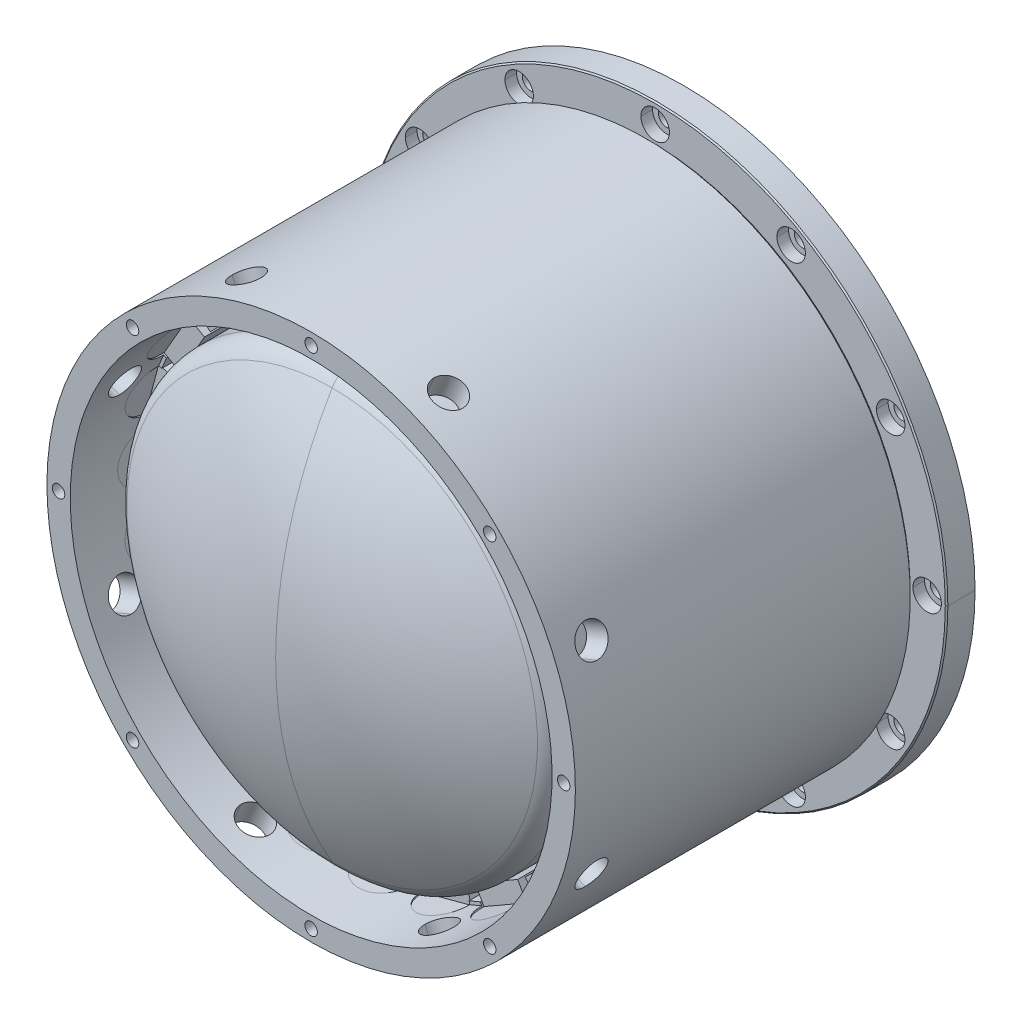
SolidWorks part; units mm, degrees
ref_plane "Front Plane" through (0, 0, 0) normal (0, 0, 1) x (1, 0, 0)
ref_plane "Top Plane" through (0, 0, 0) normal (0, 1, 0) x (1, 0, 0)
ref_plane "Right Plane" through (0, 0, 0) normal (1, 0, 0) x (0, 0, -1)
imported_body "561108_asm KTR magnetic coup.STEP-1/561108_asm.stp.STEP-1/398987_AF0_ASM.stp.STEP-1/398986_AF1_ASM.stp.STEP-1/402236_AF0_ASM.stp.STEP-1/400436_AF0.stp.STEP-1-solid1"
imported_body "561108_asm KTR magnetic coup.STEP-1/561108_asm.stp.STEP-1/398987_AF0_ASM.stp.STEP-1/398986_AF1_ASM.stp.STEP-1/402236_AF0_ASM.stp.STEP-1/400436_AF1.stp.STEP-1-solid1"
imported_body "561108_asm KTR magnetic coup.STEP-1/561108_asm.stp.STEP-1/398987_AF0_ASM.stp.STEP-1/398986_AF1_ASM.stp.STEP-1/402236_AF0_ASM.stp.STEP-1/400436_AF2.stp.STEP-1-solid1"
imported_body "561108_asm KTR magnetic coup.STEP-1/561108_asm.stp.STEP-1/398987_AF0_ASM.stp.STEP-1/398986_AF1_ASM.stp.STEP-1/402236_AF0_ASM.stp.STEP-1/400436_AF3.stp.STEP-1-solid1"
imported_body "561108_asm KTR magnetic coup.STEP-1/561108_asm.stp.STEP-1/398987_AF0_ASM.stp.STEP-1/398986_AF1_ASM.stp.STEP-1/402236_AF0_ASM.stp.STEP-1/400436_AF4.stp.STEP-1-solid1"
imported_body "561108_asm KTR magnetic coup.STEP-1/561108_asm.stp.STEP-1/398987_AF0_ASM.stp.STEP-1/398986_AF1_ASM.stp.STEP-1/402236_AF0_ASM.stp.STEP-1/400436_AF5.stp.STEP-1-solid1"
imported_body "561108_asm KTR magnetic coup.STEP-1/561108_asm.stp.STEP-1/398987_AF0_ASM.stp.STEP-1/398986_AF1_ASM.stp.STEP-1/402236_AF0_ASM.stp.STEP-1/400436_AF6.stp.STEP-1-solid1"
imported_body "561108_asm KTR magnetic coup.STEP-1/561108_asm.stp.STEP-1/398987_AF0_ASM.stp.STEP-1/398986_AF1_ASM.stp.STEP-1/402236_AF0_ASM.stp.STEP-1/400436_AF7.stp.STEP-1-solid1"
imported_body "561108_asm KTR magnetic coup.STEP-1/561108_asm.stp.STEP-1/398987_AF0_ASM.stp.STEP-1/398986_AF1_ASM.stp.STEP-1/402236_AF0_ASM.stp.STEP-1/400436_AF8.stp.STEP-1-solid1"
imported_body "561108_asm KTR magnetic coup.STEP-1/561108_asm.stp.STEP-1/398987_AF0_ASM.stp.STEP-1/398986_AF1_ASM.stp.STEP-1/402236_AF0_ASM.stp.STEP-1/400436_AF9.stp.STEP-1-solid1"
imported_body "561108_asm KTR magnetic coup.STEP-1/561108_asm.stp.STEP-1/398987_AF0_ASM.stp.STEP-1/398986_AF1_ASM.stp.STEP-1/402236_AF0_ASM.stp.STEP-1/400436_AF10.stp.STEP-1-solid1"
imported_body "561108_asm KTR magnetic coup.STEP-1/561108_asm.stp.STEP-1/398987_AF0_ASM.stp.STEP-1/398986_AF1_ASM.stp.STEP-1/402236_AF0_ASM.stp.STEP-1/400436_AF11.stp.STEP-1-solid1"
imported_body "561108_asm KTR magnetic coup.STEP-1/561108_asm.stp.STEP-1/398987_AF0_ASM.stp.STEP-1/398986_AF1_ASM.stp.STEP-1/402236_AF0_ASM.stp.STEP-1/400436_AF12.stp.STEP-1-solid1"
imported_body "561108_asm KTR magnetic coup.STEP-1/561108_asm.stp.STEP-1/398987_AF0_ASM.stp.STEP-1/398986_AF1_ASM.stp.STEP-1/402236_AF0_ASM.stp.STEP-1/400436_AF13.stp.STEP-1-solid1"
imported_body "561108_asm KTR magnetic coup.STEP-1/561108_asm.stp.STEP-1/398987_AF0_ASM.stp.STEP-1/398986_AF1_ASM.stp.STEP-1/402236_AF0_ASM.stp.STEP-1/400436_AF14.stp.STEP-1-solid1"
imported_body "561108_asm KTR magnetic coup.STEP-1/561108_asm.stp.STEP-1/398987_AF0_ASM.stp.STEP-1/398986_AF1_ASM.stp.STEP-1/402236_AF0_ASM.stp.STEP-1/400436_AF15.stp.STEP-1-solid1"
imported_body "561108_asm KTR magnetic coup.STEP-1/561108_asm.stp.STEP-1/398987_AF0_ASM.stp.STEP-1/398986_AF1_ASM.stp.STEP-1/402236_AF0_ASM.stp.STEP-1/400436_AF16.stp.STEP-1-solid1"
imported_body "561108_asm KTR magnetic coup.STEP-1/561108_asm.stp.STEP-1/398987_AF0_ASM.stp.STEP-1/398986_AF1_ASM.stp.STEP-1/402236_AF0_ASM.stp.STEP-1/400436_AF17.stp.STEP-1-solid1"
imported_body "561108_asm KTR magnetic coup.STEP-1/561108_asm.stp.STEP-1/398987_AF0_ASM.stp.STEP-1/398986_AF1_ASM.stp.STEP-1/402236_AF0_ASM.stp.STEP-1/400436_AF18.stp.STEP-1-solid1"
imported_body "561108_asm KTR magnetic coup.STEP-1/561108_asm.stp.STEP-1/398987_AF0_ASM.stp.STEP-1/398986_AF1_ASM.stp.STEP-1/402236_AF0_ASM.stp.STEP-1/400436_AF19.stp.STEP-1-solid1"
imported_body "561108_asm KTR magnetic coup.STEP-1/561108_asm.stp.STEP-1/398987_AF0_ASM.stp.STEP-1/398986_AF1_ASM.stp.STEP-1/402236_AF0_ASM.stp.STEP-1/400436_AF20.stp.STEP-1-solid1"
imported_body "561108_asm KTR magnetic coup.STEP-1/561108_asm.stp.STEP-1/398987_AF0_ASM.stp.STEP-1/398986_AF1_ASM.stp.STEP-1/402236_AF0_ASM.stp.STEP-1/400436_AF21.stp.STEP-1-solid1"
imported_body "561108_asm KTR magnetic coup.STEP-1/561108_asm.stp.STEP-1/398987_AF0_ASM.stp.STEP-1/398986_AF1_ASM.stp.STEP-1/402236_AF0_ASM.stp.STEP-1/400436_AF22.stp.STEP-1-solid1"
imported_body "561108_asm KTR magnetic coup.STEP-1/561108_asm.stp.STEP-1/398987_AF0_ASM.stp.STEP-1/398986_AF1_ASM.stp.STEP-1/402236_AF0_ASM.stp.STEP-1/400436_AF23.stp.STEP-1-solid1"
imported_body "561108_asm KTR magnetic coup.STEP-1/561108_asm.stp.STEP-1/398987_AF0_ASM.stp.STEP-1/398986_AF1_ASM.stp.STEP-1/397990_AF2_ASM.stp.STEP-1/397983_AF24.stp.STEP-1-solid1"
imported_body "561108_asm KTR magnetic coup.STEP-1/561108_asm.stp.STEP-1/398987_AF0_ASM.stp.STEP-1/398986_AF1_ASM.stp.STEP-1/397990_AF2_ASM.stp.STEP-1/397983_AF25.stp.STEP-1-solid1"
imported_body "561108_asm KTR magnetic coup.STEP-1/561108_asm.stp.STEP-1/398987_AF0_ASM.stp.STEP-1/398986_AF1_ASM.stp.STEP-1/397990_AF2_ASM.stp.STEP-1/397983_AF26.stp.STEP-1-solid1"
imported_body "561108_asm KTR magnetic coup.STEP-1/561108_asm.stp.STEP-1/398987_AF0_ASM.stp.STEP-1/398986_AF1_ASM.stp.STEP-1/397990_AF2_ASM.stp.STEP-1/397983_AF27.stp.STEP-1-solid1"
imported_body "561108_asm KTR magnetic coup.STEP-1/561108_asm.stp.STEP-1/398987_AF0_ASM.stp.STEP-1/398986_AF1_ASM.stp.STEP-1/397990_AF2_ASM.stp.STEP-1/397983_AF28.stp.STEP-1-solid1"
imported_body "561108_asm KTR magnetic coup.STEP-1/561108_asm.stp.STEP-1/398987_AF0_ASM.stp.STEP-1/398986_AF1_ASM.stp.STEP-1/397990_AF2_ASM.stp.STEP-1/397983_AF29.stp.STEP-1-solid1"
imported_body "561108_asm KTR magnetic coup.STEP-1/561108_asm.stp.STEP-1/398987_AF0_ASM.stp.STEP-1/398986_AF1_ASM.stp.STEP-1/397990_AF2_ASM.stp.STEP-1/397983_AF30.stp.STEP-1-solid1"
imported_body "561108_asm KTR magnetic coup.STEP-1/561108_asm.stp.STEP-1/398987_AF0_ASM.stp.STEP-1/398986_AF1_ASM.stp.STEP-1/397990_AF2_ASM.stp.STEP-1/397983_AF31.stp.STEP-1-solid1"
imported_body "561108_asm KTR magnetic coup.STEP-1/561108_asm.stp.STEP-1/398987_AF0_ASM.stp.STEP-1/398986_AF1_ASM.stp.STEP-1/397990_AF2_ASM.stp.STEP-1/397983_AF32.stp.STEP-1-solid1"
imported_body "561108_asm KTR magnetic coup.STEP-1/561108_asm.stp.STEP-1/398987_AF0_ASM.stp.STEP-1/398986_AF1_ASM.stp.STEP-1/397990_AF2_ASM.stp.STEP-1/397983_AF33.stp.STEP-1-solid1"
imported_body "561108_asm KTR magnetic coup.STEP-1/561108_asm.stp.STEP-1/398987_AF0_ASM.stp.STEP-1/398986_AF1_ASM.stp.STEP-1/397990_AF2_ASM.stp.STEP-1/397983_AF34.stp.STEP-1-solid1"
imported_body "561108_asm KTR magnetic coup.STEP-1/561108_asm.stp.STEP-1/398987_AF0_ASM.stp.STEP-1/398986_AF1_ASM.stp.STEP-1/397990_AF2_ASM.stp.STEP-1/397983_AF35.stp.STEP-1-solid1"
imported_body "561108_asm KTR magnetic coup.STEP-1/561108_asm.stp.STEP-1/398987_AF0_ASM.stp.STEP-1/398986_AF1_ASM.stp.STEP-1/397990_AF2_ASM.stp.STEP-1/397983_AF36.stp.STEP-1-solid1"
imported_body "561108_asm KTR magnetic coup.STEP-1/561108_asm.stp.STEP-1/398987_AF0_ASM.stp.STEP-1/398986_AF1_ASM.stp.STEP-1/397990_AF2_ASM.stp.STEP-1/397983_AF37.stp.STEP-1-solid1"
imported_body "561108_asm KTR magnetic coup.STEP-1/561108_asm.stp.STEP-1/398987_AF0_ASM.stp.STEP-1/398986_AF1_ASM.stp.STEP-1/397990_AF2_ASM.stp.STEP-1/397983_AF38.stp.STEP-1-solid1"
imported_body "561108_asm KTR magnetic coup.STEP-1/561108_asm.stp.STEP-1/398987_AF0_ASM.stp.STEP-1/398986_AF1_ASM.stp.STEP-1/397990_AF2_ASM.stp.STEP-1/397983_AF39.stp.STEP-1-solid1"
imported_body "561108_asm KTR magnetic coup.STEP-1/561108_asm.stp.STEP-1/398987_AF0_ASM.stp.STEP-1/398986_AF1_ASM.stp.STEP-1/397990_AF2_ASM.stp.STEP-1/397983_AF40.stp.STEP-1-solid1"
imported_body "561108_asm KTR magnetic coup.STEP-1/561108_asm.stp.STEP-1/398987_AF0_ASM.stp.STEP-1/398986_AF1_ASM.stp.STEP-1/397990_AF2_ASM.stp.STEP-1/397983_AF41.stp.STEP-1-solid1"
imported_body "561108_asm KTR magnetic coup.STEP-1/561108_asm.stp.STEP-1/398987_AF0_ASM.stp.STEP-1/398986_AF1_ASM.stp.STEP-1/397990_AF2_ASM.stp.STEP-1/397983_AF42.stp.STEP-1-solid1"
imported_body "561108_asm KTR magnetic coup.STEP-1/561108_asm.stp.STEP-1/398987_AF0_ASM.stp.STEP-1/398986_AF1_ASM.stp.STEP-1/397990_AF2_ASM.stp.STEP-1/397983_AF43.stp.STEP-1-solid1"
imported_body "561108_asm KTR magnetic coup.STEP-1/561108_asm.stp.STEP-1/398987_AF0_ASM.stp.STEP-1/398986_AF1_ASM.stp.STEP-1/397990_AF2_ASM.stp.STEP-1/397983_AF44.stp.STEP-1-solid1"
imported_body "561108_asm KTR magnetic coup.STEP-1/561108_asm.stp.STEP-1/398987_AF0_ASM.stp.STEP-1/398986_AF1_ASM.stp.STEP-1/397990_AF2_ASM.stp.STEP-1/397983_AF45.stp.STEP-1-solid1"
imported_body "561108_asm KTR magnetic coup.STEP-1/561108_asm.stp.STEP-1/398987_AF0_ASM.stp.STEP-1/398986_AF1_ASM.stp.STEP-1/397990_AF2_ASM.stp.STEP-1/397983_AF46.stp.STEP-1-solid1"
imported_body "561108_asm KTR magnetic coup.STEP-1/561108_asm.stp.STEP-1/398987_AF0_ASM.stp.STEP-1/398986_AF1_ASM.stp.STEP-1/397990_AF2_ASM.stp.STEP-1/397983_AF47.stp.STEP-1-solid1"
imported_body "561108_asm KTR magnetic coup.STEP-1/561108_asm.stp.STEP-1/398987_AF0_ASM.stp.STEP-1/398986_AF1_ASM.stp.STEP-1/398984_AF2.stp.STEP-1-solid1"
imported_body "561108_asm KTR magnetic coup.STEP-1/561108_asm.stp.STEP-1/398987_AF0_ASM.stp.STEP-1/398986_AF1_ASM.stp.STEP-1/398983_AF2.stp.STEP-1-solid1"
imported_body "561108_asm KTR magnetic coup.STEP-1/561108_asm.stp.STEP-1/398987_AF0_ASM.stp.STEP-1/438211_AF1_ASM.stp.STEP-1/438210_AF0.stp.STEP-1-solid1"
imported_body "561108_asm KTR magnetic coup.STEP-1/561108_asm.stp.STEP-1/398987_AF0_ASM.stp.STEP-1/438211_AF1_ASM.stp.STEP-1/436052_AF0.stp.STEP-1-solid1"
imported_body "561108_asm KTR magnetic coup.STEP-1/561108_asm.stp.STEP-1/533978_ASM.stp.STEP-1/522625_AF0.stp.STEP-1-solid1"
imported_body "561108_asm KTR magnetic coup.STEP-1/561108_asm.stp.STEP-1/533994_ASM.stp.STEP-1/534002_ASM.stp.STEP-1/440571.stp.STEP-1-solid1"
imported_body "561108_asm KTR magnetic coup.STEP-1/561108_asm.stp.STEP-1/533994_ASM.stp.STEP-1/534002_ASM.stp.STEP-1/440571.stp.STEP-2-solid1"
imported_body "561108_asm KTR magnetic coup.STEP-1/561108_asm.stp.STEP-1/533994_ASM.stp.STEP-1/534002_ASM.stp.STEP-1/440571.stp.STEP-3-solid1"
imported_body "561108_asm KTR magnetic coup.STEP-1/561108_asm.stp.STEP-1/533994_ASM.stp.STEP-1/534002_ASM.stp.STEP-1/440571.stp.STEP-4-solid1"
imported_body "561108_asm KTR magnetic coup.STEP-1/561108_asm.stp.STEP-1/533994_ASM.stp.STEP-1/534002_ASM.stp.STEP-1/440571.stp.STEP-5-solid1"
imported_body "561108_asm KTR magnetic coup.STEP-1/561108_asm.stp.STEP-1/533994_ASM.stp.STEP-1/534002_ASM.stp.STEP-1/440571.stp.STEP-6-solid1"
imported_body "561108_asm KTR magnetic coup.STEP-1/561108_asm.stp.STEP-1/533994_ASM.stp.STEP-1/534002_ASM.stp.STEP-1/440571.stp.STEP-7-solid1"
imported_body "561108_asm KTR magnetic coup.STEP-1/561108_asm.stp.STEP-1/533994_ASM.stp.STEP-1/534002_ASM.stp.STEP-1/440571.stp.STEP-8-solid1"
imported_body "561108_asm KTR magnetic coup.STEP-1/561108_asm.stp.STEP-1/533994_ASM.stp.STEP-1/534002_ASM.stp.STEP-1/440571.stp.STEP-9-solid1"
imported_body "561108_asm KTR magnetic coup.STEP-1/561108_asm.stp.STEP-1/533994_ASM.stp.STEP-1/534002_ASM.stp.STEP-1/440571.stp.STEP-10-solid1"
imported_body "561108_asm KTR magnetic coup.STEP-1/561108_asm.stp.STEP-1/533994_ASM.stp.STEP-1/534002_ASM.stp.STEP-1/440571.stp.STEP-11-solid1"
imported_body "561108_asm KTR magnetic coup.STEP-1/561108_asm.stp.STEP-1/533994_ASM.stp.STEP-1/534002_ASM.stp.STEP-1/440571.stp.STEP-12-solid1"
imported_body "561108_asm KTR magnetic coup.STEP-1/561108_asm.stp.STEP-1/533994_ASM.stp.STEP-1/534002_ASM.stp.STEP-1/440571.stp.STEP-13-solid1"
imported_body "561108_asm KTR magnetic coup.STEP-1/561108_asm.stp.STEP-1/533994_ASM.stp.STEP-1/534002_ASM.stp.STEP-1/440571.stp.STEP-14-solid1"
imported_body "561108_asm KTR magnetic coup.STEP-1/561108_asm.stp.STEP-1/533994_ASM.stp.STEP-1/534002_ASM.stp.STEP-1/440571.stp.STEP-15-solid1"
imported_body "561108_asm KTR magnetic coup.STEP-1/561108_asm.stp.STEP-1/533994_ASM.stp.STEP-1/534002_ASM.stp.STEP-1/440571.stp.STEP-16-solid1"
imported_body "561108_asm KTR magnetic coup.STEP-1/561108_asm.stp.STEP-1/533994_ASM.stp.STEP-1/534002_ASM.stp.STEP-1/440571.stp.STEP-17-solid1"
imported_body "561108_asm KTR magnetic coup.STEP-1/561108_asm.stp.STEP-1/533994_ASM.stp.STEP-1/534002_ASM.stp.STEP-1/440571.stp.STEP-18-solid1"
imported_body "561108_asm KTR magnetic coup.STEP-1/561108_asm.stp.STEP-1/533994_ASM.stp.STEP-1/534002_ASM.stp.STEP-1/440571.stp.STEP-19-solid1"
imported_body "561108_asm KTR magnetic coup.STEP-1/561108_asm.stp.STEP-1/533994_ASM.stp.STEP-1/534002_ASM.stp.STEP-1/440571.stp.STEP-20-solid1"
imported_body "561108_asm KTR magnetic coup.STEP-1/561108_asm.stp.STEP-1/533994_ASM.stp.STEP-1/534002_ASM.stp.STEP-1/440571.stp.STEP-21-solid1"
imported_body "561108_asm KTR magnetic coup.STEP-1/561108_asm.stp.STEP-1/533994_ASM.stp.STEP-1/534002_ASM.stp.STEP-1/440571.stp.STEP-22-solid1"
imported_body "561108_asm KTR magnetic coup.STEP-1/561108_asm.stp.STEP-1/533994_ASM.stp.STEP-1/534002_ASM.stp.STEP-1/440571.stp.STEP-23-solid1"
imported_body "561108_asm KTR magnetic coup.STEP-1/561108_asm.stp.STEP-1/533994_ASM.stp.STEP-1/534002_ASM.stp.STEP-1/440571.stp.STEP-24-solid1"
imported_body "561108_asm KTR magnetic coup.STEP-1/561108_asm.stp.STEP-1/533994_ASM.stp.STEP-1/534003_ASM.stp.STEP-1/469764.stp.STEP-1-solid1"
imported_body "561108_asm KTR magnetic coup.STEP-1/561108_asm.stp.STEP-1/533994_ASM.stp.STEP-1/534003_ASM.stp.STEP-1/469764.stp.STEP-2-solid1"
imported_body "561108_asm KTR magnetic coup.STEP-1/561108_asm.stp.STEP-1/533994_ASM.stp.STEP-1/534003_ASM.stp.STEP-1/469764.stp.STEP-3-solid1"
imported_body "561108_asm KTR magnetic coup.STEP-1/561108_asm.stp.STEP-1/533994_ASM.stp.STEP-1/534003_ASM.stp.STEP-1/469764.stp.STEP-4-solid1"
imported_body "561108_asm KTR magnetic coup.STEP-1/561108_asm.stp.STEP-1/533994_ASM.stp.STEP-1/534003_ASM.stp.STEP-1/469764.stp.STEP-5-solid1"
imported_body "561108_asm KTR magnetic coup.STEP-1/561108_asm.stp.STEP-1/533994_ASM.stp.STEP-1/534003_ASM.stp.STEP-1/469764.stp.STEP-6-solid1"
imported_body "561108_asm KTR magnetic coup.STEP-1/561108_asm.stp.STEP-1/533994_ASM.stp.STEP-1/534003_ASM.stp.STEP-1/469764.stp.STEP-7-solid1"
imported_body "561108_asm KTR magnetic coup.STEP-1/561108_asm.stp.STEP-1/533994_ASM.stp.STEP-1/534003_ASM.stp.STEP-1/469764.stp.STEP-8-solid1"
imported_body "561108_asm KTR magnetic coup.STEP-1/561108_asm.stp.STEP-1/533994_ASM.stp.STEP-1/534003_ASM.stp.STEP-1/469764.stp.STEP-9-solid1"
imported_body "561108_asm KTR magnetic coup.STEP-1/561108_asm.stp.STEP-1/533994_ASM.stp.STEP-1/534003_ASM.stp.STEP-1/469764.stp.STEP-10-solid1"
imported_body "561108_asm KTR magnetic coup.STEP-1/561108_asm.stp.STEP-1/533994_ASM.stp.STEP-1/534003_ASM.stp.STEP-1/469764.stp.STEP-11-solid1"
imported_body "561108_asm KTR magnetic coup.STEP-1/561108_asm.stp.STEP-1/533994_ASM.stp.STEP-1/534003_ASM.stp.STEP-1/469764.stp.STEP-12-solid1"
imported_body "561108_asm KTR magnetic coup.STEP-1/561108_asm.stp.STEP-1/533994_ASM.stp.STEP-1/534003_ASM.stp.STEP-1/469764.stp.STEP-13-solid1"
imported_body "561108_asm KTR magnetic coup.STEP-1/561108_asm.stp.STEP-1/533994_ASM.stp.STEP-1/534003_ASM.stp.STEP-1/469764.stp.STEP-14-solid1"
imported_body "561108_asm KTR magnetic coup.STEP-1/561108_asm.stp.STEP-1/533994_ASM.stp.STEP-1/534003_ASM.stp.STEP-1/469764.stp.STEP-15-solid1"
imported_body "561108_asm KTR magnetic coup.STEP-1/561108_asm.stp.STEP-1/533994_ASM.stp.STEP-1/534003_ASM.stp.STEP-1/469764.stp.STEP-16-solid1"
imported_body "561108_asm KTR magnetic coup.STEP-1/561108_asm.stp.STEP-1/533994_ASM.stp.STEP-1/534003_ASM.stp.STEP-1/469764.stp.STEP-17-solid1"
imported_body "561108_asm KTR magnetic coup.STEP-1/561108_asm.stp.STEP-1/533994_ASM.stp.STEP-1/534003_ASM.stp.STEP-1/469764.stp.STEP-18-solid1"
imported_body "561108_asm KTR magnetic coup.STEP-1/561108_asm.stp.STEP-1/533994_ASM.stp.STEP-1/534003_ASM.stp.STEP-1/469764.stp.STEP-19-solid1"
imported_body "561108_asm KTR magnetic coup.STEP-1/561108_asm.stp.STEP-1/533994_ASM.stp.STEP-1/534003_ASM.stp.STEP-1/469764.stp.STEP-20-solid1"
imported_body "561108_asm KTR magnetic coup.STEP-1/561108_asm.stp.STEP-1/533994_ASM.stp.STEP-1/534003_ASM.stp.STEP-1/469764.stp.STEP-21-solid1"
imported_body "561108_asm KTR magnetic coup.STEP-1/561108_asm.stp.STEP-1/533994_ASM.stp.STEP-1/534003_ASM.stp.STEP-1/469764.stp.STEP-22-solid1"
imported_body "561108_asm KTR magnetic coup.STEP-1/561108_asm.stp.STEP-1/533994_ASM.stp.STEP-1/534003_ASM.stp.STEP-1/469764.stp.STEP-23-solid1"
imported_body "561108_asm KTR magnetic coup.STEP-1/561108_asm.stp.STEP-1/533994_ASM.stp.STEP-1/534003_ASM.stp.STEP-1/469764.stp.STEP-24-solid1"
imported_body "561108_asm KTR magnetic coup.STEP-1/561108_asm.stp.STEP-1/533994_ASM.stp.STEP-1/533993.stp.STEP-1-solid1"
imported_body "561108_asm KTR magnetic coup.STEP-1/561108_asm.stp.STEP-1/533994_ASM.stp.STEP-1/533993.stp.STEP-1-surface1"
imported_body "561108_asm KTR magnetic coup.STEP-1/561108_asm.stp.STEP-1/533994_ASM.stp.STEP-1/533993.stp.STEP-1-surface2"
imported_body "561108_asm KTR magnetic coup.STEP-1/561108_asm.stp.STEP-1/533994_ASM.stp.STEP-1/533993.stp.STEP-1-surface3"
imported_body "561108_asm KTR magnetic coup.STEP-1/561108_asm.stp.STEP-1/533994_ASM.stp.STEP-1/533993.stp.STEP-1-surface4"
imported_body "561108_asm KTR magnetic coup.STEP-1/561108_asm.stp.STEP-1/533994_ASM.stp.STEP-1/533993.stp.STEP-1-surface5"
imported_body "561108_asm KTR magnetic coup.STEP-1/561108_asm.stp.STEP-1/533994_ASM.stp.STEP-1/533993.stp.STEP-1-surface6"
imported_body "561108_asm KTR magnetic coup.STEP-1/561108_asm.stp.STEP-1/533994_ASM.stp.STEP-1/533993.stp.STEP-1-surface7"
imported_body "561108_asm KTR magnetic coup.STEP-1/561108_asm.stp.STEP-1/533994_ASM.stp.STEP-1/533993.stp.STEP-1-surface8"
imported_body "561108_asm KTR magnetic coup.STEP-1/561108_asm.stp.STEP-1/533994_ASM.stp.STEP-1/547116.stp.STEP-1-solid1"
imported_body "561108_asm KTR magnetic coup.STEP-1/561108_asm.stp.STEP-1/534047.stp.STEP-1-solid1"
sketch "Sketch1" plane through (0, 0, 154) normal (0, 0, 1) x (1, 0, 0)
  line L0 (-46, 0) -> (-53, 0) construction
  circle A0 centre (0, 0) radius 49.5
  arc A1 (0, 53) -> (0, -53) centre (0, 0) ccw construction
  arc A2 (0, 53) -> (0, -53) centre (0, 0) ccw construction
  arc A3 (0, 46) -> (0, -46) centre (0, 0) ccw construction
  arc A4 (0, 46) -> (0, -46) centre (0, 0) ccw construction
  point P10 (-49.5, 0)
surface "Surface-Extrude2" sketch "Sketch1" parameters "D1"=25.4
split "Split1" trimming surface bodies 215 bodies to split 149 resulting bodies 216 217
ref_plane "Plane1" through (0, 0, 89) normal (0, 0, -1) x (-1, 0, 0)
mirror "Mirror1" about plane through (0, 0, 89) normal (0, 0, -1)
combine bodies "Combine2" operation type add bodies to combine 218 217
delete or keep bodies "Body-Delete/Keep 1" type delete bodies bodies 216
sketch "Sketch2" plane through (0, 0, 94) normal (0, 0, -1) x (-1, 0, 0)
  line L0 (7, 28.8) -> (-7, 28.8) construction
  line L1 (7, 28.8) -> (-7, 28.8)
  line L2 (0, 25) -> (0, 28.8) construction
  circle A0 centre (0, 0) radius 25
sketch "Sketch3" plane through (0, 0, 154) normal (0, 0, 1) x (1, 0, 0)
  arc A1 (0, -46) -> (0, 46) centre (0, 0) ccw construction
  arc A2 (0, -46) -> (0, 46) centre (0, 0) ccw
  arc A3 (0, 46) -> (0, -46) centre (0, 0) ccw construction
  arc A4 (0, 46) -> (0, -46) centre (0, 0) ccw
extrude "Boss-Extrude1" add sketch "Sketch3" against normal up to surface (130 mm away)
sketch "Sketch4" plane through (0, 0, 154) normal (0, 0, 1) x (1, 0, 0)
  circle A0 centre (0, 0) radius 36
  dimension "D1" = 72
extrude "Cut-Extrude1" cut sketch "Sketch4" against normal blind 70
sketch "Sketch5" plane through (0, 0, 24) normal (0, 0, -1) x (-1, 0, 0)
  circle A0 centre (0, 0) radius 45
  dimension "D1" = 90
extrude "Cut-Extrude2" cut sketch "Sketch5" against normal blind 70
sketch "Sketch6" plane through (0, 0, 154) normal (0, 0, 1) x (1, 0, 0)
  line L0 (0, 36) -> (0, 34.5832) construction
  line L1 (10, 41) -> (-10, 41)
  line L2 (10, 41) -> (10, 34.5832)
  line L3 (10, 34.5832) -> (-10, 34.5832)
  line L4 (-10, 41) -> (-10, 34.5832)
  line L5 (10, 41) -> (-10, 34.5832) construction
  line L6 (10, 34.5832) -> (-10, 41) construction
  circle A1 centre (0, 0) radius 36 construction
  arc A2 (10, 34.5832) -> (-10, 34.5832) centre (0, 0) ccw construction
  point P4 (0, 37.7916)
  point P10 (0, 0)
  dimension "D1" = 5
  dimension "D2" = 20
extrude "Cut-Extrude3" cut sketch "Sketch6" against normal up to surface (60 mm away)
